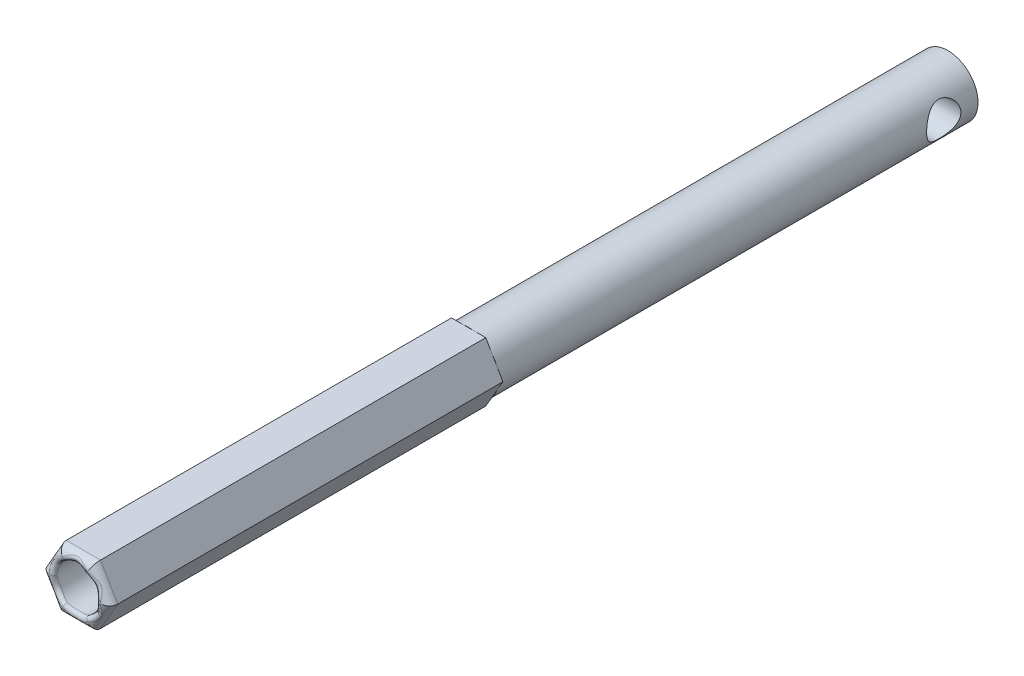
SolidWorks part; units mm, degrees
ref_plane "Plan1" through (0, 0, 0) normal (0, 0, 1) x (1, 0, 0)
ref_plane "Plan2" through (0, 0, 0) normal (0, 1, 0) x (1, 0, 0)
ref_plane "Plan3" through (0, 0, 0) normal (1, 0, 0) x (0, 0, -1)
sketch "Esquisse1" plane through (0, 0, 0) normal (0, 0, 1) x (1, 0, 0)
  circle A0 centre (0, 0) radius 1.75
  dimension "D1" = 3.5
extrude "Base-Extrusion" add sketch "Esquisse1" along normal blind 28
sketch "Esquisse2" plane through (0, 0, 28) normal (0, 0, 1) x (1, 0, 0)
  line L0 (-1, 1.7321) -> (1, 1.7321)
  line L1 (1, 1.7321) -> (2, 0)
  line L2 (2, 0) -> (1, -1.7321)
  line L3 (1, -1.7321) -> (-1, -1.7321)
  line L4 (-1, -1.7321) -> (-2, 0)
  line L5 (-2, 0) -> (-1, 1.7321)
  dimension "D2" = 2
extrude "Boss.-Extru.1" add sketch "Esquisse2" along normal blind 23
fillet "Congé1" radius 0.5 6 edges at (-1.5, 0.866, 51) (-1.5, -0.866, 51) (0, -1.7321, 51) (1.5, -0.866, 51) (1.5, 0.866, 51) (0, 1.7321, 51)
sketch "Esquisse3" plane through (0, 0, 51) normal (0, 0, 1) x (1, 0, 0)
  circle A0 centre (0, 0) radius 1.25
  dimension "D1" = 2.5
extrude "Enlèv. mat.-Extru.1" cut sketch "Esquisse3" against normal blind 20
fillet "Congé4" radius 0.2 27 edges at (-0.8364, 1.0154, 51) (-1.2976, -0.2166, 51) (-0.4612, -1.2321, 51) (0.8364, -1.0154, 51) (1.2976, 0.2166, 51) (0.4612, 1.2321, 51) (0.9154, -1.5856, 50.8536) (1.8309, 0, 50.8536) (0.9154, 1.5856, 50.8536) (-0.4612, 1.2321, 51) (-1.2976, 0.2166, 51) (0.8364, 1.0154, 51) (-0.8364, -1.0154, 51) (1.2976, -0.2166, 51) (0.4612, -1.2321, 51) (0.625, -1.0825, 51) (1.25, 0, 51) (0.625, 1.0825, 51) (-0.625, 1.0825, 51) (-1.25, 0, 51) (-0.625, -1.0825, 51)
sketch "Esquisse5" plane through (0, 0, 0) normal (1, 0, 0) x (0, 0, -1)
  line L0 (-28, 0) -> (0, 0) construction
  circle A0 centre (-2, 0) radius 1
  dimension "D2" = 2
  dimension "D1" = 2
extrude "Enlèv. mat.-Extru.2" cut sketch "Esquisse5" against normal mid plane 4
